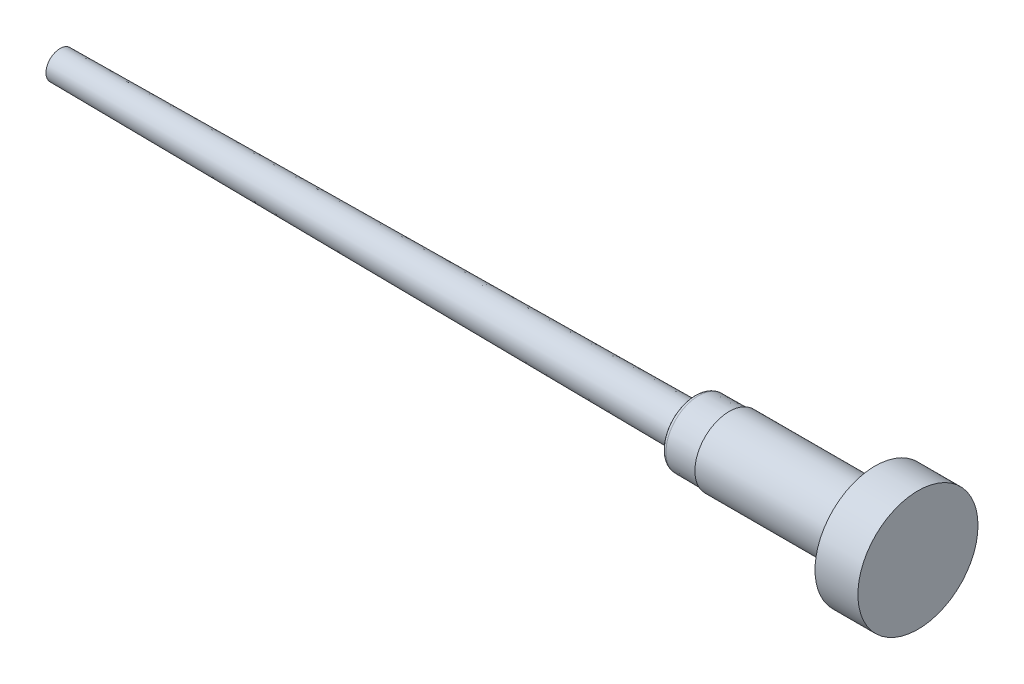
SolidWorks part; units mm, degrees
ref_plane "Plan de face" through (0, 0, 0) normal (0, 0, 1) x (1, 0, 0)
ref_plane "Plan de dessus" through (0, 0, 0) normal (0, 1, 0) x (1, 0, 0)
ref_plane "Plan de droite" through (0, 0, 0) normal (1, 0, 0) x (0, 0, -1)
sketch "Esquisse1" plane through (0, 0, 0) normal (0, 0, 1) x (1, 0, 0)
  line L0 (60.94, 3.3106) -> (60.94, -3.3106) construction
  line L1 (82, 5.375) -> (82, -5.375) construction
  line L2 (87, -5.375) -> (87, 5.375) construction
  line L3 (60.4444, 2.2793) -> (58.9298, 2.266) construction
  line L4 (65, 3.8417) -> (61.4356, 3.8106) construction
  line L5 (81.5, 4) -> (65, 4) construction
  line L7 (60.94, 3.3106) -> (60.94, 2.7792)
  line L8 (82, 7) -> (82, 4.5)
  line L9 (87, 0) -> (87, 7)
  line L10 (60.4444, 2.2793) -> (-13, 1.6383)
  line L11 (65, 3.8417) -> (61.4356, 3.8106)
  line L12 (81.5, 4) -> (65, 4)
  line L13 (82, 7) -> (87, 7)
  line L14 (87, 0) -> (-21.3054, 0) construction
  line L15 (65, 4) -> (65, 3.8417)
  line L16 (-13, 1.6383) -> (-13, 0)
  line L17 (87, 0) -> (-13, 0)
  arc A0 (60.94, 3.3106) -> (61.4356, 3.8106) centre (61.44, 3.3106) cw
  arc A1 (60.4444, 2.2793) -> (60.94, 2.7792) centre (60.44, 2.7792) ccw
  arc A2 (81.5, 4) -> (82, 4.5) centre (81.5, 4.5) ccw
  point P28 (82, 4)
  dimension "D1" = 0.5
  dimension "D2" = 14
  dimension "D3" = 100
revolve "Révolution1" add sketch "Esquisse1" angle 360 about L14
